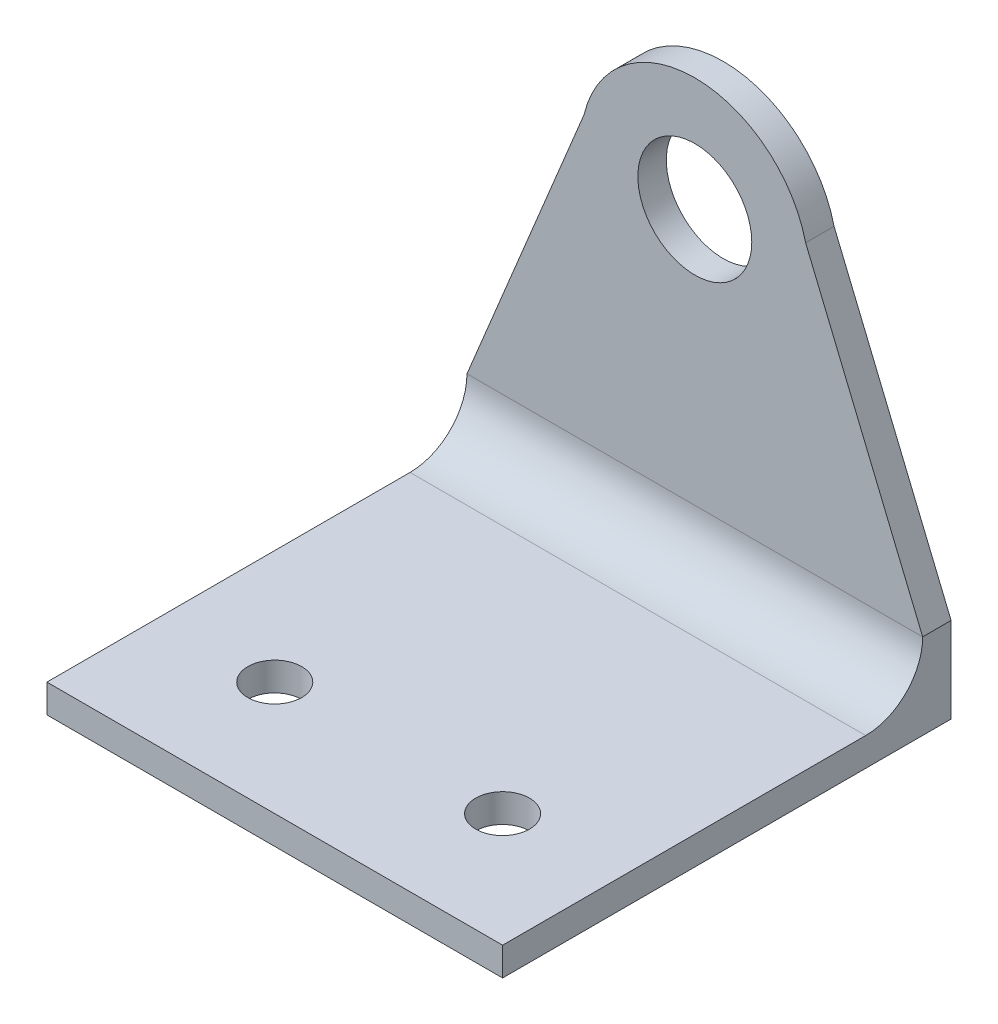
SolidWorks part; units mm, degrees
ref_plane "Front Plane" through (0, 0, 0) normal (0, 0, 1) x (1, 0, 0)
ref_plane "Top Plane" through (0, 0, 0) normal (0, 1, 0) x (1, 0, 0)
ref_plane "Right Plane" through (0, 0, 0) normal (1, 0, 0) x (0, 0, -1)
sketch "Sketch1" plane through (0, 0, 0) normal (1, 0, 0) x (0, 0, -1)
  line L0 (0, 0) -> (50, 0)
  line L1 (50, 0) -> (50, 50.8)
  line L2 (0, 3.17) -> (46.83, 3.17)
  line L3 (46.83, 3.17) -> (46.83, 50.8)
  line L4 (0, 3.17) -> (0, 0)
  line L5 (46.83, 50.8) -> (50, 50.8)
  dimension "D2" = 50
  dimension "D3" = 50.8
  dimension "D1" = 3.17
extrude "Boss-Extrude2" add sketch "Sketch1" along normal mid plane 50.8
fillet "Fillet2" radius 6.35 1 edges at (0, 3.17, -46.83)
hole_wizard "Ø6.0 (6) Diameter Hole2" positions "Sketch7" profile "Sketch6" hole size "Ø6.0" standard "ISO"
sketch "Sketch7" plane through (0, 3.17, 0) normal (0, 1, 0) x (-1, 0, 0)
  line L1 (-25.4, 0) -> (25.4, 0) construction
  line L2 (-25.4, -40.48) -> (-25.4, 0) construction
  point P0 (12.7, -12.7)
  point P1 (-12.7, -12.7)
  dimension "D1" = 38.1
  dimension "D2" = 12.7
  dimension "D3" = 12.7
  dimension "D4" = 12.7
sketch "Sketch6" plane through (-12.7, 3.17, -12.7) normal (1, 0, 0) x (0, 0, 1)
  line L0 (0, 0) -> (0, 3.17)
  line L1 (0, 3.17) -> (3, 3.17)
  line L2 (3, 3.17) -> (3, 0)
  line L5 (3, 0) -> (0, 0)
  line L11 (0, -6.35) -> (0, 107.95) construction
  dimension "Thru Hole Dia." = 6
  dimension "Thru Hole Depth" = 3.17
sketch "Sketch15" plane through (0, 0, -46.83) normal (0, 0, 1) x (1, 0, 0)
  line L0 (25.4, 50.8) -> (25.4, 9.52) construction
  line L1 (25.4, 0) -> (-25.4, 0) construction
  circle A0 centre (0, 38.1) radius 6.35
  dimension "D1" = 12.7
  dimension "D2" = 25.4
  dimension "D3" = 38.1
extrude "Cut-Extrude1" cut sketch "Sketch15" against normal through all
sketch "Sketch14" plane through (0, 0, -46.83) normal (0, 0, 1) x (1, 0, 0)
  line L0 (25.4, 50.8) -> (-25.4, 50.8) construction
  line L1 (-25.4, 9.52) -> (-10.8202, 44.7493)
  line L2 (25.4, 9.52) -> (10.8202, 44.7493)
  line L3 (25.4, 0) -> (-25.4, 0) construction
  line L4 (25.4, 0) -> (25.4, 50.8) construction
  circle A0 centre (0, 38.1) radius 12.7
  dimension "D2" = 25.4
  dimension "D3" = 38.1
  dimension "D4" = 25.4
extrude "Cut-Extrude2" cut sketch "Sketch14" against normal through all
